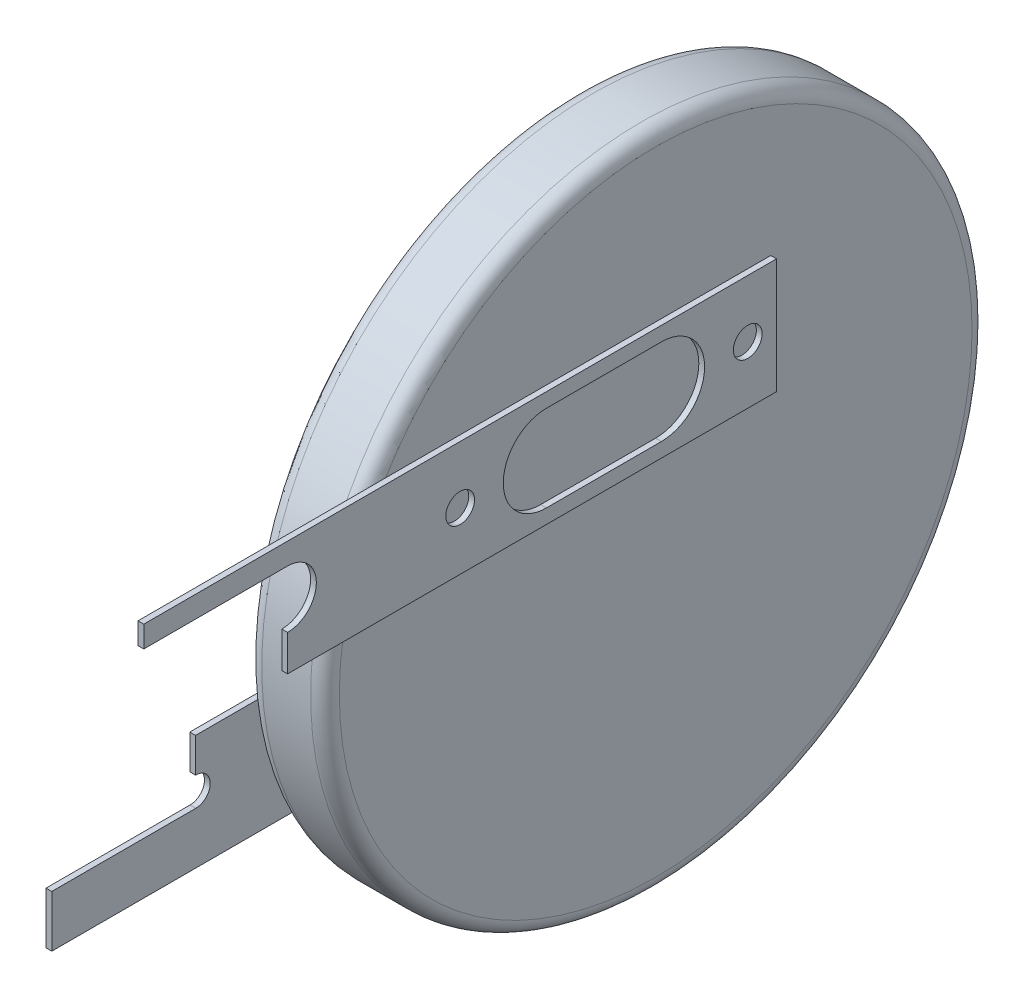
SolidWorks part; units mm, degrees
ref_plane "Front Plane" through (0, 0, 0) normal (0, 0, 1) x (1, 0, 0)
ref_plane "Top Plane" through (0, 0, 0) normal (0, 1, 0) x (1, 0, 0)
ref_plane "Right Plane" through (0, 0, 0) normal (1, 0, 0) x (0, 0, -1)
sketch "Sketch1" plane through (0, 0, 0) normal (0, 0, 1) x (1, 0, 0)
  line L0 (0, 0) -> (0, 11)
  line L1 (0, -7.358) -> (0, 7.358) construction
  line L2 (-0.5, 11.5) -> (-2.2, 11.5)
  line L3 (-2.7, 11) -> (-2.7, 9.5)
  line L4 (-2.7, 9.5) -> (-2.75, 9.5)
  line L5 (-3, 9.25) -> (-3, 0)
  line L6 (1.6976, 0) -> (-1.6976, 0) construction
  line L8 (0, 0) -> (-3, 0) construction
  line L9 (-3, 0) -> (0, 0)
  arc A0 (0, 11) -> (-0.5, 11.5) centre (-0.5, 11) ccw
  arc A1 (-2.2, 11.5) -> (-2.7, 11) centre (-2.2, 11) ccw
  arc A2 (-3, 9.25) -> (-2.75, 9.5) centre (-2.75, 9.25) cw
  point P11 (-1.35, 11.5)
  point P14 (0, 11.5)
  point P19 (-3, 9.5)
  dimension "D5" = 0.5
  dimension "D6" = 0.25
  dimension "D1" = 23
  dimension "D2" = 19
  dimension "D3" = 0.3
  dimension "D4" = 3
revolve "Revolve1" add sketch "Sketch1" angle 360 about L8
sketch "Sketch2" plane through (-3, 0, 0) normal (-1, 0, 0) x (0, 0, 1)
  line L0 (0, -3.725) -> (4, -3.725) construction
  line L1 (-4, -1.725) -> (13, -1.725)
  line L2 (-4, -1.725) -> (-4, -5.725)
  line L3 (-4, -5.725) -> (18, -5.725)
  line L4 (18, -3.925) -> (18, -5.725)
  line L5 (0, -1.65) -> (0, 1.65) construction
  line L6 (0, -2.225) -> (4, -2.225)
  line L7 (0, -5.225) -> (4, -5.225)
  line L8 (2, -2.225) -> (2, -5.225) construction
  line L9 (18, -3.925) -> (12.99, -3.925)
  line L10 (1.65, 0) -> (-1.65, 0) construction
  line L11 (12.99, -2.925) -> (13, -2.925)
  line L12 (13, -2.925) -> (13, -1.725)
  arc A0 (0, -2.225) -> (0, -5.225) centre (0, -3.725) ccw
  arc A1 (4, -5.225) -> (4, -2.225) centre (4, -3.725) ccw
  circle A2 centre (-3, -3.725) radius 0.5
  circle A3 centre (7, -3.725) radius 0.5
  circle A4 centre (0, 0) radius 11.5 construction
  arc A5 (12.99, -2.925) -> (12.99, -3.925) centre (12.99, -3.425) ccw
  point P3 (18, -4.825)
  point P8 (2, -3.725)
  dimension "D2" = 1
  dimension "D5" = 6.5
  dimension "D1" = 4
  dimension "D3" = 3
  dimension "D4" = 2
  dimension "D6" = 1.8
  dimension "D7" = 5
  dimension "D8" = 4.825
  dimension "D9" = 0.01
  dimension "D10" = 10
  dimension "D11" = 4
  dimension "D12" = 4
extrude "Boss-Extrude1" add sketch "Sketch2" along normal blind 0.2
sketch "Sketch3" plane through (0, 0, 0) normal (1, 0, 0) x (0, 0, -1)
  line L0 (-9.25, 0) -> (9.25, 0) construction
  line L1 (-18, 5.725) -> (4, 5.725)
  line L2 (-18, 5.725) -> (-18, 4.975)
  line L3 (-13, 1.725) -> (4, 1.725)
  line L4 (4, 5.725) -> (4, 1.725)
  line L5 (1.76, 0) -> (-1.76, 0) construction
  line L6 (4, -1.725) -> (4, -5.725) construction
  line L7 (4, -5.725) -> (-7.2655, -5.725) construction
  line L8 (-4, 3.725) -> (0, 3.725) construction
  line L9 (-4, 5.225) -> (0, 5.225)
  line L10 (-4, 2.225) -> (0, 2.225)
  line L11 (-4, -2.225) -> (0, -2.225) construction
  line L12 (-18, -5.725) -> (-18, -3.925) construction
  line L13 (-13, 1.725) -> (-13, 2.975)
  line L14 (-13, -2.925) -> (-13, -1.725) construction
  line L15 (-13, 4.975) -> (-18, 4.975)
  arc A0 (-7.2655, -5.725) -> (-9.0877, -1.725) centre (0, 0) ccw construction
  circle A1 centre (3, 3.725) radius 0.5
  circle A2 centre (-7, 3.725) radius 0.5
  arc A3 (-4, 5.225) -> (-4, 2.225) centre (-4, 3.725) ccw
  arc A4 (0, 2.225) -> (0, 5.225) centre (0, 3.725) ccw
  arc A5 (-4, -2.225) -> (-4, -5.225) centre (-4, -3.725) ccw construction
  circle A6 centre (-7, -3.725) radius 0.5 construction
  arc A7 (-13, 2.975) -> (-13, 4.975) centre (-13, 3.975) ccw
  point P19 (-2, 3.725)
  point P39 (4, 3.725)
  dimension "D2" = 1
  dimension "D1" = 0.75
extrude "Boss-Extrude2" add sketch "Sketch3" along normal blind 0.2
